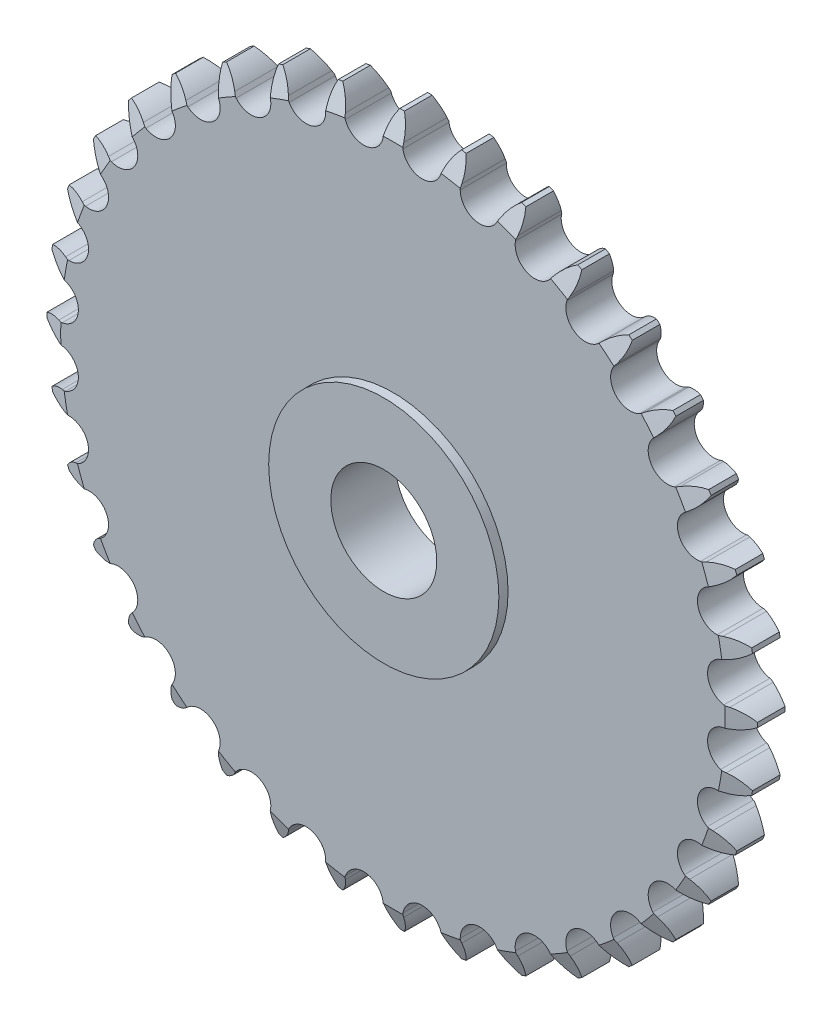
SolidWorks part; units mm, degrees
ref_plane "Front Plane" through (0, 0, 0) normal (0, 0, 1) x (1, 0, 0)
ref_plane "Top Plane" through (0, 0, 0) normal (0, 1, 0) x (1, 0, 0)
ref_plane "Right Plane" through (0, 0, 0) normal (1, 0, 0) x (0, 0, -1)
sketch "Sketch1" plane through (0, 0, 0) normal (0, 0, 1) x (1, 0, 0)
  line L0 (0, 0) -> (0, 72.8581) construction
  line L1 (-2.1568, 71.8581) -> (2.1568, 71.8581) construction
  line L2 (-2.1568, 71.8581) -> (-2.0429, 72.8581) construction
  line L3 (2.1568, 71.8581) -> (2.0429, 72.8581) construction
  line L4 (-2.0429, 72.8581) -> (2.0429, 72.8581) construction
  line L7 (-0.5, 77.163) -> (0.5, 77.163) construction
  circle A0 centre (0, 0) radius 72.8581 construction
  circle A1 centre (6.35, 72.5808) radius 4.255 construction
  circle A2 centre (-6.35, 72.5808) radius 4.255 construction
  circle A3 centre (0, 0) radius 68.6031 construction
  arc A4 (-2.0429, 72.8581) -> (-0.5, 77.163) centre (7.8928, 71.726) cw construction
  arc A5 (2.0429, 72.8581) -> (0.5, 77.163) centre (-7.8928, 71.726) ccw construction
  dimension "D1" = 13
  dimension "SprocketPitchDiameter" = 145.7162
  dimension "RollerDia" = 8.51
  dimension "D4" = 10
  dimension "ChainPitch" = 12.7
  dimension "D2" = 1
  dimension "D3" = 1
  dimension "D5" = 1
sketch "Sketch2" plane through (0, 0, 0) normal (0, 0, 1) x (1, 0, 0)
  circle A0 centre (0, 0) radius 68.6031 construction
  circle A1 centre (0, 0) radius 68.6031
extrude "Boss-Extrude1" add sketch "Sketch2" along normal mid plane 10
sketch "Sketch4" plane through (0, 0, 0) normal (0, 0, 1) x (1, 0, 0)
  line L0 (-0.5, 77.163) -> (0.5, 77.163) construction
  line L1 (-2.1568, 71.8581) -> (-2.0429, 72.8581) construction
  line L2 (2.1568, 71.8581) -> (2.0429, 72.8581) construction
  line L3 (-0.5, 77.163) -> (0.5, 77.163)
  line L4 (-2.1568, 71.8581) -> (-2.0429, 72.8581)
  line L5 (2.1568, 71.8581) -> (2.0429, 72.8581)
  circle A0 centre (0, 0) radius 68.6031 construction
  circle A1 centre (6.35, 72.5808) radius 4.255 construction
  circle A2 centre (-6.35, 72.5808) radius 4.255 construction
  arc A3 (2.0429, 72.8581) -> (0.5, 77.163) centre (-7.8928, 71.726) ccw construction
  arc A4 (-0.5, 77.163) -> (-2.0429, 72.8581) centre (7.8928, 71.726) ccw construction
  arc A5 (5.9792, 68.342) -> (-5.9792, 68.342) centre (0, 0) ccw
  arc A6 (2.1568, 71.8581) -> (5.9792, 68.342) centre (6.35, 72.5808) ccw
  arc A7 (-5.9792, 68.342) -> (-2.1568, 71.8581) centre (-6.35, 72.5808) ccw
  arc A8 (2.0429, 72.8581) -> (0.5, 77.163) centre (-7.8928, 71.726) ccw
  arc A9 (-0.5, 77.163) -> (-2.0429, 72.8581) centre (7.8928, 71.726) ccw
extrude "Boss-Extrude2" add sketch "Sketch4" along normal up to surface and the other way up to surface
pattern_circular "CirPattern1" count 36 over 360 about axis through (0, 0, 0) along (0, 0, 1) of "Boss-Extrude2"
sketch "Sketch5" plane through (0, 0, 0) normal (1, 0, 0) x (0, 0, -1)
  line L0 (0, 0) -> (-6, 0) construction
  line L1 (0, 77.163) -> (0, 72.8581) construction
  line L2 (-6, 84.663) -> (6, 84.663)
  line L3 (-6, 84.663) -> (-6, 69.663)
  line L4 (-6, 69.663) -> (6, 69.663) construction
  line L5 (6, 84.663) -> (6, 69.663)
  line L6 (-6, 84.663) -> (6, 69.663) construction
  line L7 (-6, 69.663) -> (6, 84.663) construction
  line L8 (-6, 69.663) -> (0, 84.663)
  line L9 (6, 69.663) -> (0, 84.663)
  line L10 (0, 77.163) -> (0, 72.8581) construction
  point P1 (0, 77.163)
  dimension "D1" = 15
  dimension "D2" = 1
revolve "Cut-Revolve7" cut sketch "Sketch5" angle 360 about L0
sketch "Sketch6" plane through (0, 0, 0) normal (0, 0, 1) x (1, 0, 0)
  circle A0 centre (0, 0) radius 25
  dimension "D1" = 50
extrude "Boss-Extrude3" add sketch "Sketch6" along normal mid plane 14
sketch "Sketch7" plane through (0, 0, 0) normal (0, 0, 1) x (1, 0, 0)
  circle A0 centre (0, 0) radius 11.5
  dimension "D1" = 23
extrude "Cut-Extrude1" cut sketch "Sketch7" against normal through all both and the other way through all
equation "\"ChainPitch\"=12.7"
equation "\"ChainPitch@Sketch1\"=\"ChainPitch\""
equation "\"SprocketPitchDiameter@Sketch1\" = \"ChainPitch\" / sin ( 180 / \"NumberOfTeeth\" )"
equation "\"NumberOfTeeth\"= 36"
equation "\"D1@CirPattern1\"=\"NumberOfTeeth\""
